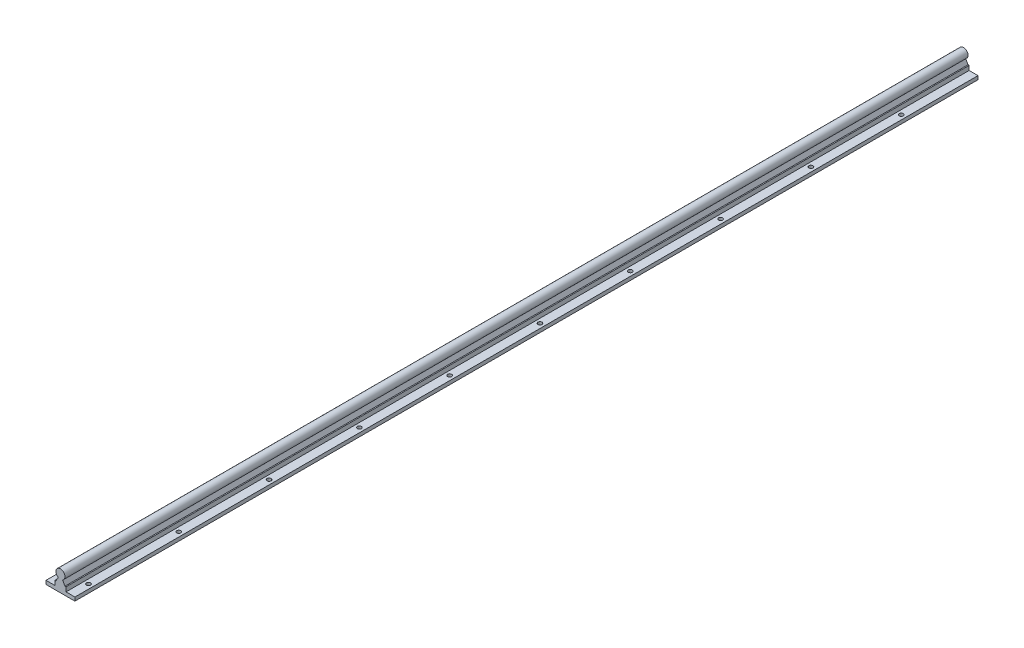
SolidWorks part; units mm, degrees
ref_plane "Front Plane" through (0, 0, 0) normal (0, 0, 1) x (1, 0, 0)
ref_plane "Top Plane" through (0, 0, 0) normal (0, 1, 0) x (1, 0, 0)
ref_plane "Right Plane" through (0, 0, 0) normal (1, 0, 0) x (0, 0, -1)
sketch "Sketch1" plane through (0, 0, 0) normal (0, 0, 1) x (1, 0, 0)
  line L0 (5, -2.6) -> (2.35, 2.0867)
  line L1 (-2.35, 2.0867) -> (-5, -2.6)
  line L2 (-5, -2.6) -> (-6.2, -2.6)
  line L3 (-6.2, -2.6) -> (-6.2, -7.5)
  line L4 (-6.2, -7.5) -> (-16, -7.5)
  line L5 (-16, -7.5) -> (-16, -11.5)
  line L6 (-16, -11.5) -> (16, -11.5)
  line L7 (16, -11.5) -> (16, -7.5)
  line L8 (16, -7.5) -> (6.2, -7.5)
  line L9 (6.2, -7.5) -> (6.2, -2.6)
  line L10 (6.2, -2.6) -> (5, -2.6)
  arc A0 (2.35, 2.0867) -> (-2.35, 2.0867) centre (0, 6.5) ccw
extrude "Boss-Extrude1" add sketch "Sketch1" along normal blind 1000
sketch "Sketch2" plane through (0, -7.5, 0) normal (0, 1, 0) x (1, 0, 0)
  line L2 (16, -1000) -> (6.2, -1000) construction
  line L3 (16, -1000) -> (16, 0) construction
  point P1 (11, -980)
  point P2 (0, 0)
  point P5 (11.1, -1000)
  dimension "D1" = 20
  dimension "D2" = 5
hole_wizard "Ø4.5 (4.5) Diameter Hole1" positions "Sketch2" profile "Sketch3" hole size "Ø4.5" standard "DIN"
sketch "Sketch3" plane through (11, -7.5, 980) normal (1, 0, 0) x (0, 0, 1)
  line L0 (0, 0) -> (0, 4)
  line L1 (0, 4) -> (2.25, 4)
  line L2 (2.25, 4) -> (2.25, 0)
  line L5 (2.25, 0) -> (0, 0)
  line L11 (0, -6.35) -> (0, 107.95) construction
  dimension "Thru Hole Dia." = 4.5
  dimension "Thru Hole Depth" = 4
mirror "Mirror3" about plane through (0, 0, 0) normal (1, 0, 0) of "Ø4.5 (4.5) Diameter Hole1"
other "Fill Pattern2" parameters "D5"=0, "D6"=0, "D1"=100, "D2"=60, "D3"=0, "D9"=10, "D7"=11, "D8"=2
